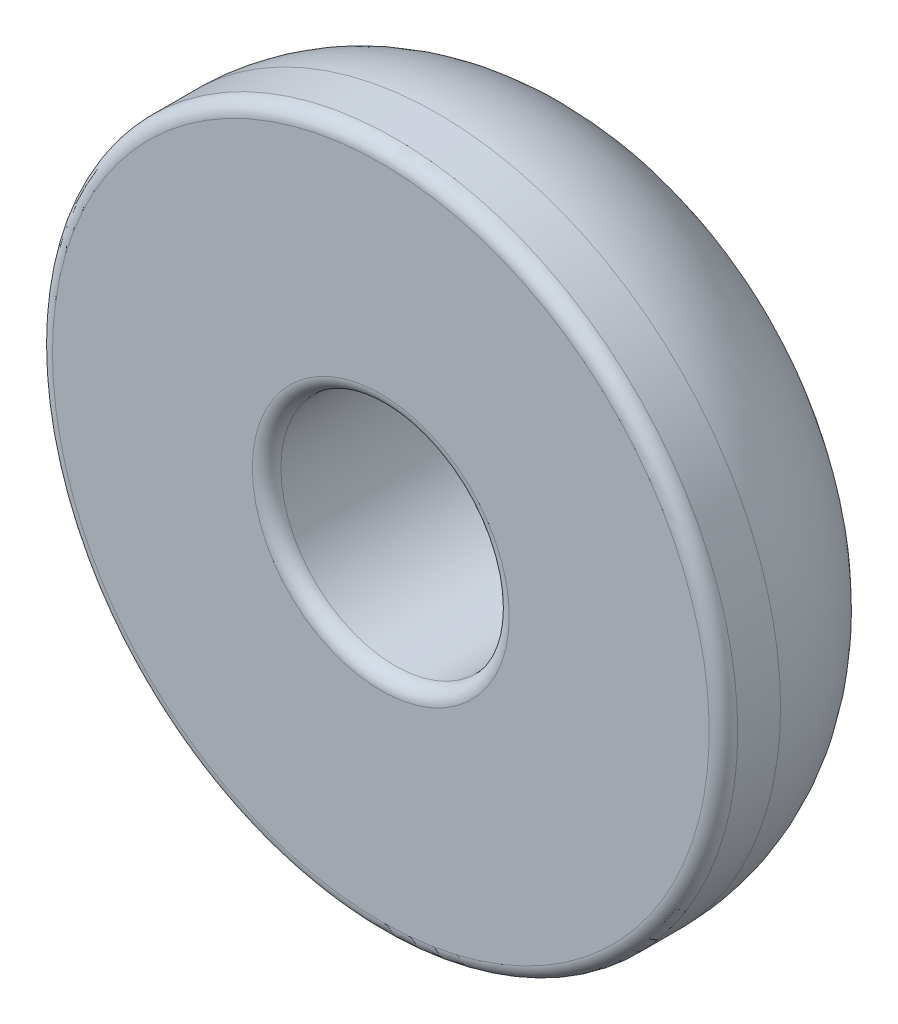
SolidWorks part; units mm, degrees
ref_plane "Спереди" through (0, 0, 0) normal (0, 0, 1) x (1, 0, 0)
ref_plane "Сверху" through (0, 0, 0) normal (0, 1, 0) x (1, 0, 0)
ref_plane "Справа" through (0, 0, 0) normal (1, 0, 0) x (0, 0, -1)
sketch "Эскиз1" plane through (0, 0, 0) normal (1, 0, 0) x (0, 0, -1)
  line L0 (-4, 0) -> (4, 0) construction
  line L1 (4, 4) -> (-4, 4)
  line L2 (-4, 4) -> (-4, 12)
  line L3 (-4, 12) -> (-2, 12)
  line L4 (4, 6) -> (4, 4)
  arc A0 (-2, 12) -> (4, 6) centre (-2, 6) cw
  dimension "D4" = 6
  dimension "D1" = 8
  dimension "D2" = 24
  dimension "D3" = 8
revolve "Повернуть1" add sketch "Эскиз1" angle 360 about L0
fillet "Скругление1" radius 0.5 3 edges at (4, 0, 4) (4, 0, -4) (12, 0, 4)
